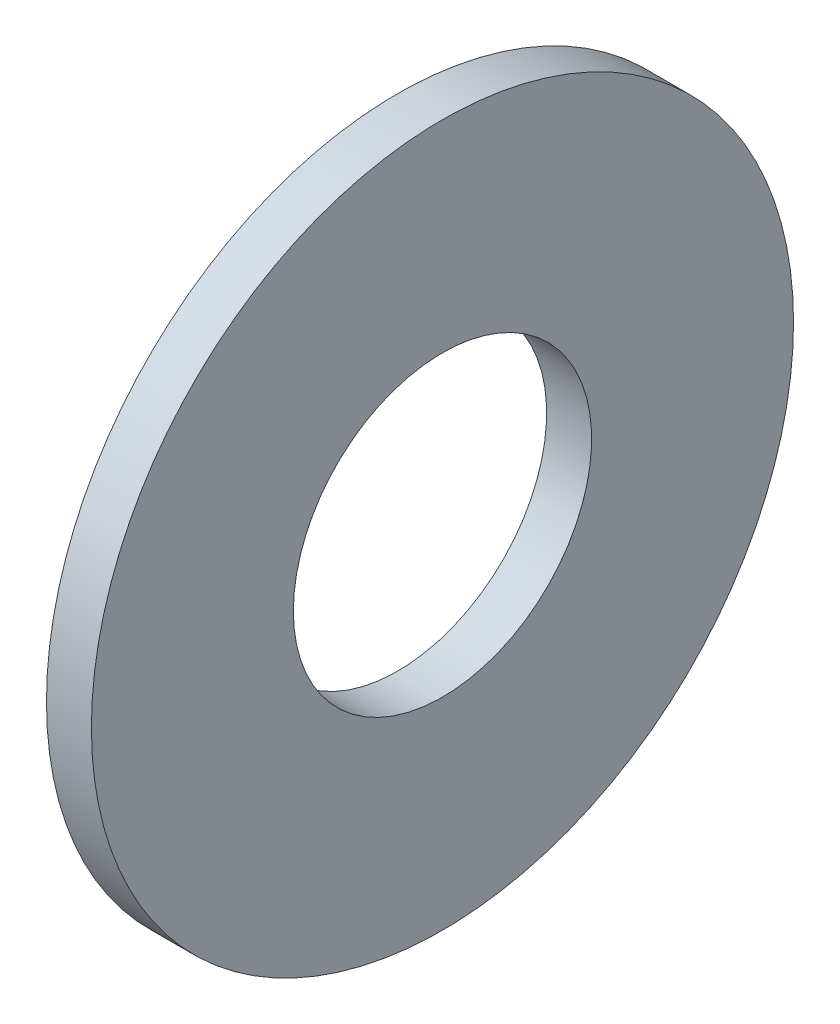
SolidWorks part; units mm, degrees
ref_plane "Plane1" through (0, 0, 0) normal (0, 0, 1) x (1, 0, 0)
ref_plane "Plane2" through (0, 0, 0) normal (0, 1, 0) x (1, 0, 0)
ref_plane "Plane3" through (0, 0, 0) normal (1, 0, 0) x (0, 0, -1)
other "Configuration Table"
sketch "Sketch1" plane through (0, 0, 0) normal (0, 0, 1) x (1, 0, 0)
  line L0 (-34.925, 0) -> (9.525, 0) construction
  line L1 (0, 13.4874) -> (0, 31.75)
  line L2 (0, 31.75) -> (-4.064, 31.75)
  line L3 (-4.064, 31.75) -> (-4.064, 13.4874)
  line L4 (-4.064, 13.4874) -> (0, 13.4874)
  dimension "Thickness" = 4.064
  dimension "Inside_dia" = 26.9748
  dimension "Outside_dia" = 63.5
revolve "Base-Revolve" add sketch "Sketch1" angle 360 about L0
